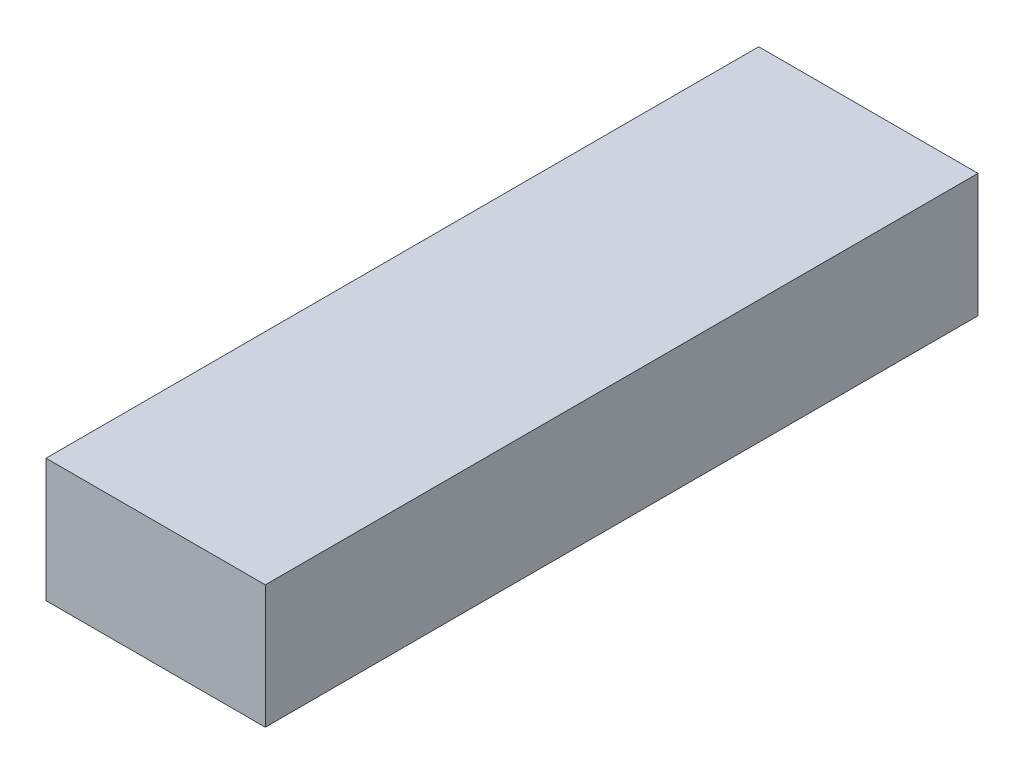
SolidWorks part; units mm, degrees
ref_plane "Front Plane" through (0, 0, 0) normal (0, 0, 1) x (1, 0, 0)
ref_plane "Top Plane" through (0, 0, 0) normal (0, 1, 0) x (1, 0, 0)
ref_plane "Right Plane" through (0, 0, 0) normal (1, 0, 0) x (0, 0, -1)
sketch "Sketch1" plane through (0, 0, 0) normal (0, 0, 1) x (1, 0, 0)
  line L1 (-8, 4.5) -> (8, 4.5)
  line L2 (-8, 4.5) -> (-8, -4.5)
  line L3 (-8, -4.5) -> (8, -4.5)
  line L4 (8, 4.5) -> (8, -4.5)
  line L5 (-8, 4.5) -> (8, -4.5) construction
  line L6 (-8, -4.5) -> (8, 4.5) construction
  point P0 (0, 0)
  dimension "D1" = 9
  dimension "D2" = 16
extrude "Boss-Extrude1" add sketch "Sketch1" along normal blind 52
